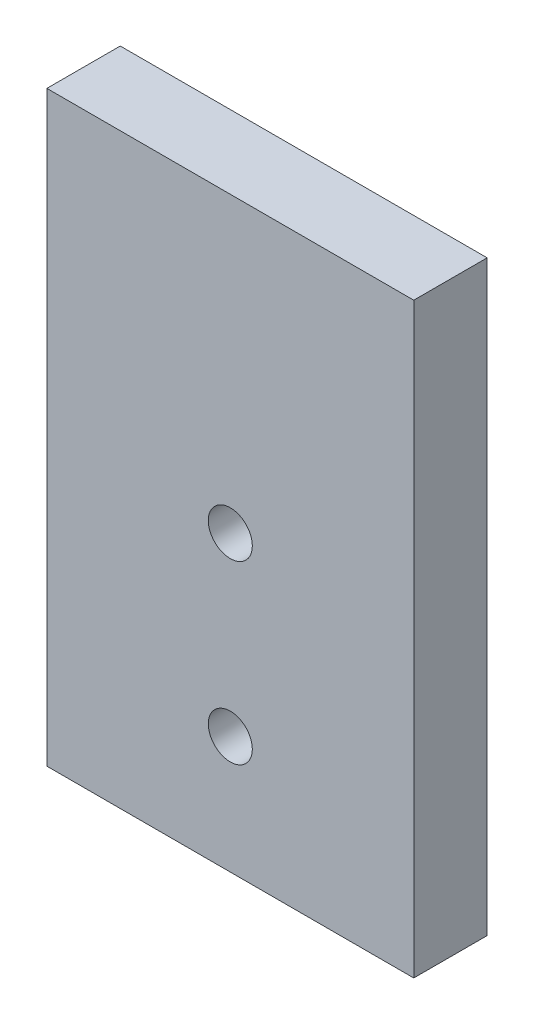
SolidWorks part; units mm, degrees
ref_plane "Plan de face" through (0, 0, 0) normal (0, 0, 1) x (1, 0, 0)
ref_plane "Plan de dessus" through (0, 0, 0) normal (0, 1, 0) x (1, 0, 0)
ref_plane "Plan de droite" through (0, 0, 0) normal (1, 0, 0) x (0, 0, -1)
sketch "Esquisse1" plane through (0, 0, 0) normal (0, 0, 1) x (1, 0, 0)
  line L1 (0, 0) -> (50, 0)
  line L2 (0, 0) -> (0, 80)
  line L3 (0, 80) -> (50, 80)
  line L4 (50, 0) -> (50, 80)
  dimension "D1" = 50
  dimension "D2" = 80
extrude "Boss.-Extru.1" add sketch "Esquisse1" along normal blind 10
sketch "Esquisse2" plane through (0, 0, 10) normal (0, 0, 1) x (1, 0, 0)
  line L0 (0, 80) -> (0, 0) construction
  line L1 (0, 0) -> (50, 0) construction
  line L2 (50, 80) -> (0, 80) construction
  circle A0 centre (25, 16) radius 3
  circle A1 centre (25, 40) radius 3
  dimension "D1" = 6
  dimension "D2" = 6
  dimension "D3" = 25
  dimension "D4" = 25
  dimension "D5" = 16
  dimension "D6" = 40
extrude "Enlèv. mat.-Extru.1" cut sketch "Esquisse2" against normal blind 10
